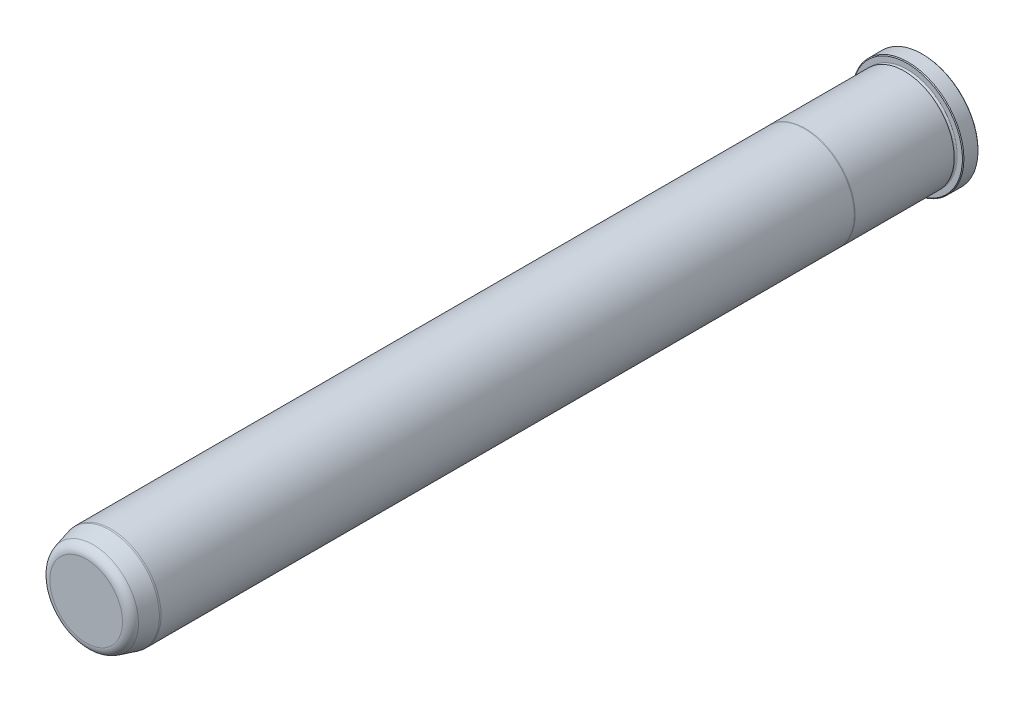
SolidWorks part; units mm, degrees
ref_plane "Front Plane" through (0, 0, 0) normal (0, 0, 1) x (1, 0, 0)
ref_plane "Top Plane" through (0, 0, 0) normal (0, 1, 0) x (1, 0, 0)
ref_plane "Right Plane" through (0, 0, 0) normal (1, 0, 0) x (0, 0, -1)
sketch "Sketch1" plane through (0, 0, 0) normal (1, 0, 0) x (0, 0, -1)
  line L0 (0, 0) -> (0, 28.448)
  line L1 (0, 28.448) -> (-7.9248, 28.448)
  line L2 (-7.9248, 28.448) -> (-7.9248, 25.3873)
  line L3 (-7.9248, 24.6253) -> (-9.4488, 24.6253) construction
  line L4 (-9.4488, 25.3873) -> (-9.4488, 25.4127)
  line L5 (-9.4488, 25.4127) -> (-59.8348, 25.4127)
  line L6 (-59.8348, 25.4127) -> (-60.198, 25.3873)
  line L7 (-60.198, 25.3873) -> (-412.75, 25.3873)
  line L9 (-425.45, 22.1219) -> (-425.45, 0)
  line L10 (-425.45, 0) -> (0, 0)
  line L11 (0, 0) -> (13.6287, 0) construction
  line L12 (-412.75, 25.3873) -> (-413.512, 25.3206)
  line L13 (-413.512, 25.3206) -> (-425.45, 22.1219)
  arc A0 (-9.4488, 25.3873) -> (-7.9248, 25.3873) centre (-8.6868, 25.3873) ccw
  dimension "D14" = 1.524
  dimension "D1" = 7.9248
  dimension "D2" = 1.524
  dimension "D3" = 56.896
  dimension "D4" = 50.8254
  dimension "D5" = 60.198
  dimension "D6" = 425.45
  dimension "D7" = 0.7874
  dimension "D8" = 4
  dimension "D9" = 50.7746
  dimension "D10" = 5
  dimension "D11" = 15
  dimension "D12" = 0.762
  dimension "D13" = 12.7
revolve "Revolve1" add sketch "Sketch1" angle 360 about L11
fillet "Fillet6" radius 4.7625 1 edges at (22.1219, 0, 425.45)
chamfer "Chamfer1" distance 0.381 angle 45 2 edges at (28.448, 0, 0) (28.448, 0, 7.9248)
